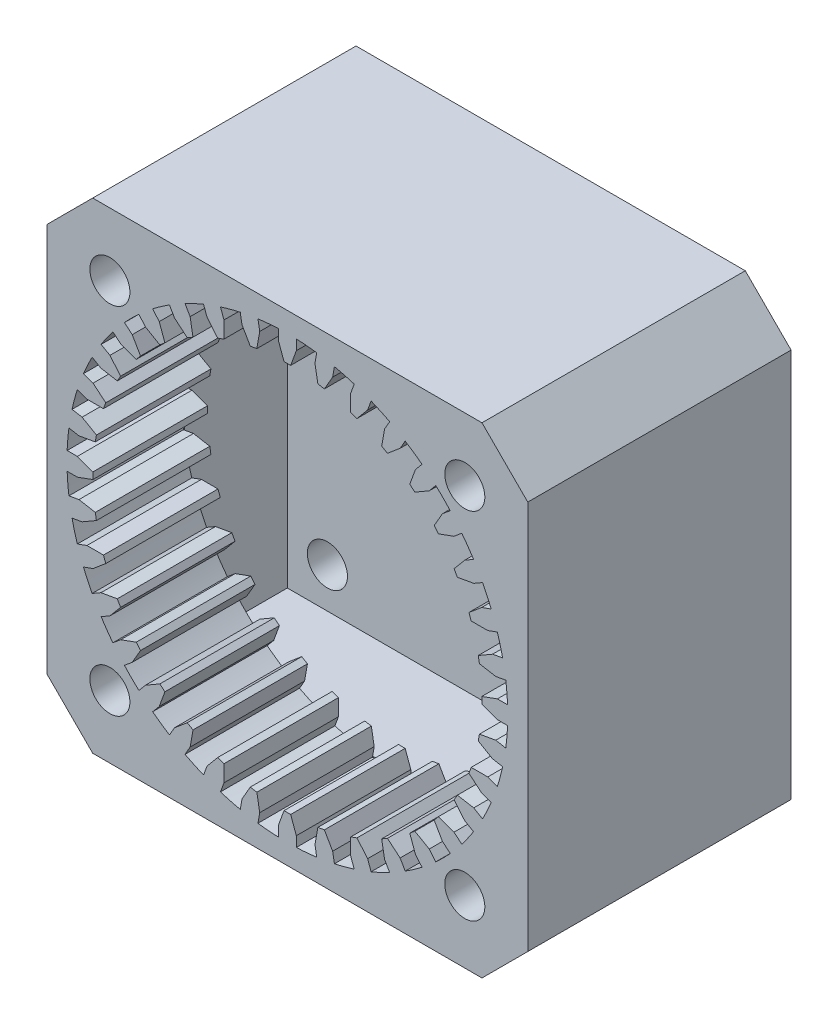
SolidWorks part; units mm, degrees
ref_plane "Piano frontale" through (0, 0, 0) normal (0, 0, 1) x (1, 0, 0)
ref_plane "Piano superiore" through (0, 0, 0) normal (0, 1, 0) x (1, 0, 0)
ref_plane "Piano destro" through (0, 0, 0) normal (1, 0, 0) x (0, 0, -1)
sketch "Schizzo1" plane through (0, 0, 0) normal (0, 0, 1) x (1, 0, 0)
  line L1 (21, -21) -> (-21, -21)
  line L2 (21, -21) -> (21, 21)
  line L3 (21, 21) -> (-21, 21)
  line L4 (-21, -21) -> (-21, 21)
  line L5 (21, -21) -> (-21, 21) construction
  line L6 (21, 21) -> (-21, -21) construction
  point P0 (0, 0)
  dimension "D1" = 42
  dimension "D2" = 42
extrude "Estrusione-Estrusione1" add sketch "Schizzo1" along normal blind 13
sketch "Schizzo2" plane through (0, 0, 13) normal (0, 0, 1) x (1, 0, 0)
  line L1 (19, -19) -> (-19, -19)
  line L2 (19, -19) -> (19, 19)
  line L3 (19, 19) -> (-19, 19)
  line L4 (-19, -19) -> (-19, 19)
  line L5 (19, -19) -> (-19, 19) construction
  line L6 (19, 19) -> (-19, -19) construction
  point P0 (0, 0)
  dimension "D1" = 38
  dimension "D2" = 38
extrude "Taglio-Estrusione1" cut sketch "Schizzo2" against normal blind 9
sketch "Schizzo3" plane through (0, 0, 4) normal (0, 0, 1) x (1, 0, 0)
  line L0 (0, 16.6126) -> (0, -15.5) construction
  line L7 (-15.8688, 0) -> (16.532, 0) construction
  circle A0 centre (-15.5, 15.5) radius 1.75
  circle A1 centre (15.5, 15.5) radius 1.75
  circle A2 centre (15.5, -15.5) radius 1.75
  circle A3 centre (-15.5, -15.5) radius 1.75
  point P0 (0, 0)
  dimension "D3" = 3.5
  dimension "D1" = 31
  dimension "D2" = 31
extrude "Taglio-Estrusione2" cut sketch "Schizzo3" against normal through all
sketch "Schizzo4" plane through (0, 0, 13) normal (0, 0, 1) x (1, 0, 0)
  line L0 (-24.8225, 0) -> (21.9573, 0) construction
  line L1 (19.234, 0.785) -> (18.344, 0.785)
  line L2 (18.344, 0.785) -> (16.984, 0.29)
  line L3 (16.984, 0.29) -> (16.984, -0.29)
  line L4 (16.984, -0.29) -> (18.344, -0.785)
  line L5 (18.344, -0.785) -> (19.234, -0.785)
  line L6 (18.2016, -2.4123) -> (16.7763, -2.6636)
  line L7 (19.0781, -2.5669) -> (18.2016, -2.4123)
  line L8 (16.7763, -2.6636) -> (16.6756, -3.2348)
  line L9 (16.6756, -3.2348) -> (17.929, -3.9585)
  line L10 (17.929, -3.9585) -> (18.8055, -4.113)
  line L11 (17.5062, -5.5364) -> (16.0589, -5.5364)
  line L12 (18.3425, -5.8408) -> (17.5062, -5.5364)
  line L13 (16.0589, -5.5364) -> (15.8605, -6.0814)
  line L14 (15.8605, -6.0814) -> (16.9692, -7.0117)
  line L15 (16.9692, -7.0117) -> (17.8056, -7.3161)
  line L16 (16.2789, -8.4922) -> (14.8536, -8.2408)
  line L17 (17.0496, -8.9372) -> (16.2789, -8.4922)
  line L18 (14.8536, -8.2408) -> (14.5636, -8.7431)
  line L19 (14.5636, -8.7431) -> (15.4939, -9.8518)
  line L20 (15.4939, -9.8518) -> (16.2646, -10.2968)
  line L21 (14.5569, -11.1899) -> (13.1969, -10.6949)
  line L22 (15.2387, -11.762) -> (14.5569, -11.1899)
  line L23 (13.1969, -10.6949) -> (12.8241, -11.1392)
  line L24 (12.8241, -11.1392) -> (13.5477, -12.3926)
  line L25 (13.5477, -12.3926) -> (14.2295, -12.9647)
  line L26 (12.3926, -13.5477) -> (11.1392, -12.8241)
  line L27 (12.9647, -14.2295) -> (12.3926, -13.5477)
  line L28 (11.1392, -12.8241) -> (10.6949, -13.1969)
  line L29 (10.6949, -13.1969) -> (11.1899, -14.5569)
  line L30 (11.1899, -14.5569) -> (11.762, -15.2387)
  line L31 (9.8518, -15.4939) -> (8.7431, -14.5636)
  line L32 (10.2968, -16.2646) -> (9.8518, -15.4939)
  line L33 (8.7431, -14.5636) -> (8.2408, -14.8536)
  line L34 (8.2408, -14.8536) -> (8.4922, -16.2789)
  line L35 (8.4922, -16.2789) -> (8.9372, -17.0496)
  line L36 (7.0117, -16.9692) -> (6.0814, -15.8605)
  line L37 (7.3161, -17.8056) -> (7.0117, -16.9692)
  line L38 (6.0814, -15.8605) -> (5.5364, -16.0589)
  line L39 (5.5364, -16.0589) -> (5.5364, -17.5062)
  line L40 (5.5364, -17.5062) -> (5.8408, -18.3425)
  line L41 (3.9585, -17.929) -> (3.2348, -16.6756)
  line L42 (4.113, -18.8055) -> (3.9585, -17.929)
  line L43 (3.2348, -16.6756) -> (2.6636, -16.7763)
  line L44 (2.6636, -16.7763) -> (2.4123, -18.2016)
  line L45 (2.4123, -18.2016) -> (2.5669, -19.0781)
  line L46 (0.785, -18.344) -> (0.29, -16.984)
  line L47 (0.785, -19.234) -> (0.785, -18.344)
  line L48 (0.29, -16.984) -> (-0.29, -16.984)
  line L49 (-0.29, -16.984) -> (-0.785, -18.344)
  line L50 (-0.785, -18.344) -> (-0.785, -19.234)
  line L51 (-2.4123, -18.2016) -> (-2.6636, -16.7763)
  line L52 (-2.5669, -19.0781) -> (-2.4123, -18.2016)
  line L53 (-2.6636, -16.7763) -> (-3.2348, -16.6756)
  line L54 (-3.2348, -16.6756) -> (-3.9585, -17.929)
  line L55 (-3.9585, -17.929) -> (-4.113, -18.8055)
  line L56 (-5.5364, -17.5062) -> (-5.5364, -16.0589)
  line L57 (-5.8408, -18.3425) -> (-5.5364, -17.5062)
  line L58 (-5.5364, -16.0589) -> (-6.0814, -15.8605)
  line L59 (-6.0814, -15.8605) -> (-7.0117, -16.9692)
  line L60 (-7.0117, -16.9692) -> (-7.3161, -17.8056)
  line L61 (-8.4922, -16.2789) -> (-8.2408, -14.8536)
  line L62 (-8.9372, -17.0496) -> (-8.4922, -16.2789)
  line L63 (-8.2408, -14.8536) -> (-8.7431, -14.5636)
  line L64 (-8.7431, -14.5636) -> (-9.8518, -15.4939)
  line L65 (-9.8518, -15.4939) -> (-10.2968, -16.2646)
  line L66 (-11.1899, -14.5569) -> (-10.6949, -13.1969)
  line L67 (-11.762, -15.2387) -> (-11.1899, -14.5569)
  line L68 (-10.6949, -13.1969) -> (-11.1392, -12.8241)
  line L69 (-11.1392, -12.8241) -> (-12.3926, -13.5477)
  line L70 (-12.3926, -13.5477) -> (-12.9647, -14.2295)
  line L71 (-13.5477, -12.3926) -> (-12.8241, -11.1392)
  line L72 (-14.2295, -12.9647) -> (-13.5477, -12.3926)
  line L73 (-12.8241, -11.1392) -> (-13.1969, -10.6949)
  line L74 (-13.1969, -10.6949) -> (-14.5569, -11.1899)
  line L75 (-14.5569, -11.1899) -> (-15.2387, -11.762)
  line L76 (-15.4939, -9.8518) -> (-14.5636, -8.7431)
  line L77 (-16.2646, -10.2968) -> (-15.4939, -9.8518)
  line L78 (-14.5636, -8.7431) -> (-14.8536, -8.2408)
  line L79 (-14.8536, -8.2408) -> (-16.2789, -8.4922)
  line L80 (-16.2789, -8.4922) -> (-17.0496, -8.9372)
  line L81 (-16.9692, -7.0117) -> (-15.8605, -6.0814)
  line L82 (-17.8056, -7.3161) -> (-16.9692, -7.0117)
  line L83 (-15.8605, -6.0814) -> (-16.0589, -5.5364)
  line L84 (-16.0589, -5.5364) -> (-17.5062, -5.5364)
  line L85 (-17.5062, -5.5364) -> (-18.3425, -5.8408)
  line L86 (-17.929, -3.9585) -> (-16.6756, -3.2348)
  line L87 (-18.8055, -4.113) -> (-17.929, -3.9585)
  line L88 (-16.6756, -3.2348) -> (-16.7763, -2.6636)
  line L89 (-16.7763, -2.6636) -> (-18.2016, -2.4123)
  line L90 (-18.2016, -2.4123) -> (-19.0781, -2.5669)
  line L91 (-18.344, -0.785) -> (-16.984, -0.29)
  line L92 (-19.234, -0.785) -> (-18.344, -0.785)
  line L93 (-16.984, -0.29) -> (-16.984, 0.29)
  line L94 (-16.984, 0.29) -> (-18.344, 0.785)
  line L95 (-18.344, 0.785) -> (-19.234, 0.785)
  line L96 (-18.2016, 2.4123) -> (-16.7763, 2.6636)
  line L97 (-19.0781, 2.5669) -> (-18.2016, 2.4123)
  line L98 (-16.7763, 2.6636) -> (-16.6756, 3.2348)
  line L99 (-16.6756, 3.2348) -> (-17.929, 3.9585)
  line L100 (-17.929, 3.9585) -> (-18.8055, 4.113)
  line L101 (-17.5062, 5.5364) -> (-16.0589, 5.5364)
  line L102 (-18.3425, 5.8408) -> (-17.5062, 5.5364)
  line L103 (-16.0589, 5.5364) -> (-15.8605, 6.0814)
  line L104 (-15.8605, 6.0814) -> (-16.9692, 7.0117)
  line L105 (-16.9692, 7.0117) -> (-17.8056, 7.3161)
  line L106 (-16.2789, 8.4922) -> (-14.8536, 8.2408)
  line L107 (-17.0496, 8.9372) -> (-16.2789, 8.4922)
  line L108 (-14.8536, 8.2408) -> (-14.5636, 8.7431)
  line L109 (-14.5636, 8.7431) -> (-15.4939, 9.8518)
  line L110 (-15.4939, 9.8518) -> (-16.2646, 10.2968)
  line L111 (-14.5569, 11.1899) -> (-13.1969, 10.6949)
  line L112 (-15.2387, 11.762) -> (-14.5569, 11.1899)
  line L113 (-13.1969, 10.6949) -> (-12.8241, 11.1392)
  line L114 (-12.8241, 11.1392) -> (-13.5477, 12.3926)
  line L115 (-13.5477, 12.3926) -> (-14.2295, 12.9647)
  line L116 (-12.3926, 13.5477) -> (-11.1392, 12.8241)
  line L117 (-12.9647, 14.2295) -> (-12.3926, 13.5477)
  line L118 (-11.1392, 12.8241) -> (-10.6949, 13.1969)
  line L119 (-10.6949, 13.1969) -> (-11.1899, 14.5569)
  line L120 (-11.1899, 14.5569) -> (-11.762, 15.2387)
  line L121 (-9.8518, 15.4939) -> (-8.7431, 14.5636)
  line L122 (-10.2968, 16.2646) -> (-9.8518, 15.4939)
  line L123 (-8.7431, 14.5636) -> (-8.2408, 14.8536)
  line L124 (-8.2408, 14.8536) -> (-8.4922, 16.2789)
  line L125 (-8.4922, 16.2789) -> (-8.9372, 17.0496)
  line L126 (-7.0117, 16.9692) -> (-6.0814, 15.8605)
  line L127 (-7.3161, 17.8056) -> (-7.0117, 16.9692)
  line L128 (-6.0814, 15.8605) -> (-5.5364, 16.0589)
  line L129 (-5.5364, 16.0589) -> (-5.5364, 17.5062)
  line L130 (-5.5364, 17.5062) -> (-5.8408, 18.3425)
  line L131 (-3.9585, 17.929) -> (-3.2348, 16.6756)
  line L132 (-4.113, 18.8055) -> (-3.9585, 17.929)
  line L133 (-3.2348, 16.6756) -> (-2.6636, 16.7763)
  line L134 (-2.6636, 16.7763) -> (-2.4123, 18.2016)
  line L135 (-2.4123, 18.2016) -> (-2.5669, 19.0781)
  line L136 (-0.785, 18.344) -> (-0.29, 16.984)
  line L137 (-0.785, 19.234) -> (-0.785, 18.344)
  line L138 (-0.29, 16.984) -> (0.29, 16.984)
  line L139 (0.29, 16.984) -> (0.785, 18.344)
  line L140 (0.785, 18.344) -> (0.785, 19.234)
  line L141 (2.4123, 18.2016) -> (2.6636, 16.7763)
  line L142 (2.5669, 19.0781) -> (2.4123, 18.2016)
  line L143 (2.6636, 16.7763) -> (3.2348, 16.6756)
  line L144 (3.2348, 16.6756) -> (3.9585, 17.929)
  line L145 (3.9585, 17.929) -> (4.113, 18.8055)
  line L146 (5.5364, 17.5062) -> (5.5364, 16.0589)
  line L147 (5.8408, 18.3425) -> (5.5364, 17.5062)
  line L148 (5.5364, 16.0589) -> (6.0814, 15.8605)
  line L149 (6.0814, 15.8605) -> (7.0117, 16.9692)
  line L150 (7.0117, 16.9692) -> (7.3161, 17.8056)
  line L151 (8.4922, 16.2789) -> (8.2408, 14.8536)
  line L152 (8.9372, 17.0496) -> (8.4922, 16.2789)
  line L153 (8.2408, 14.8536) -> (8.7431, 14.5636)
  line L154 (8.7431, 14.5636) -> (9.8518, 15.4939)
  line L155 (9.8518, 15.4939) -> (10.2968, 16.2646)
  line L156 (11.1899, 14.5569) -> (10.6949, 13.1969)
  line L157 (11.762, 15.2387) -> (11.1899, 14.5569)
  line L158 (10.6949, 13.1969) -> (11.1392, 12.8241)
  line L159 (11.1392, 12.8241) -> (12.3926, 13.5477)
  line L160 (12.3926, 13.5477) -> (12.9647, 14.2295)
  line L161 (13.5477, 12.3926) -> (12.8241, 11.1392)
  line L162 (14.2295, 12.9647) -> (13.5477, 12.3926)
  line L163 (12.8241, 11.1392) -> (13.1969, 10.6949)
  line L164 (13.1969, 10.6949) -> (14.5569, 11.1899)
  line L165 (14.5569, 11.1899) -> (15.2387, 11.762)
  line L166 (15.4939, 9.8518) -> (14.5636, 8.7431)
  line L167 (16.2646, 10.2968) -> (15.4939, 9.8518)
  line L168 (14.5636, 8.7431) -> (14.8536, 8.2408)
  line L169 (14.8536, 8.2408) -> (16.2789, 8.4922)
  line L170 (16.2789, 8.4922) -> (17.0496, 8.9372)
  line L171 (16.9692, 7.0117) -> (15.8605, 6.0814)
  line L172 (17.8056, 7.3161) -> (16.9692, 7.0117)
  line L173 (15.8605, 6.0814) -> (16.0589, 5.5364)
  line L174 (16.0589, 5.5364) -> (17.5062, 5.5364)
  line L175 (17.5062, 5.5364) -> (18.3425, 5.8408)
  line L176 (17.929, 3.9585) -> (16.6756, 3.2348)
  line L177 (18.8055, 4.113) -> (17.929, 3.9585)
  line L178 (16.6756, 3.2348) -> (16.7763, 2.6636)
  line L179 (16.7763, 2.6636) -> (18.2016, 2.4123)
  line L180 (18.2016, 2.4123) -> (19.0781, 2.5669)
  line L185 (-21, 21) -> (-21, -21)
  line L186 (-21, -21) -> (21, -21)
  line L187 (21, -21) -> (21, 21)
  line L188 (21, 21) -> (-21, 21)
  line L189 (-21, 21) -> (-21, -21)
  line L190 (-21, -21) -> (21, -21)
  line L191 (21, -21) -> (21, 21)
  line L192 (21, 21) -> (-21, 21)
  arc A0 (17.0496, -8.9372) -> (17.8056, -7.3161) centre (0, 0) ccw
  arc A1 (15.2387, -11.762) -> (16.2646, -10.2968) centre (0, 0) ccw
  arc A2 (12.9647, -14.2295) -> (14.2295, -12.9647) centre (0, 0) ccw
  arc A3 (10.2968, -16.2646) -> (11.762, -15.2387) centre (0, 0) ccw
  arc A4 (7.3161, -17.8056) -> (8.9372, -17.0496) centre (0, 0) ccw
  arc A5 (4.113, -18.8055) -> (5.8408, -18.3425) centre (0, 0) ccw
  arc A6 (0.785, -19.234) -> (2.5669, -19.0781) centre (0, 0) ccw
  arc A7 (-2.5669, -19.0781) -> (-0.785, -19.234) centre (0, 0) ccw
  arc A8 (-5.8408, -18.3425) -> (-4.113, -18.8055) centre (0, 0) ccw
  arc A9 (-8.9372, -17.0496) -> (-7.3161, -17.8056) centre (0, 0) ccw
  arc A10 (-11.762, -15.2387) -> (-10.2968, -16.2646) centre (0, 0) ccw
  arc A11 (-14.2295, -12.9647) -> (-12.9647, -14.2295) centre (0, 0) ccw
  arc A12 (-16.2646, -10.2968) -> (-15.2387, -11.762) centre (0, 0) ccw
  arc A13 (-17.8056, -7.3161) -> (-17.0496, -8.9372) centre (0, 0) ccw
  arc A14 (-18.8055, -4.113) -> (-18.3425, -5.8408) centre (0, 0) ccw
  arc A15 (-19.234, -0.785) -> (-19.0781, -2.5669) centre (0, 0) ccw
  arc A16 (-19.0781, 2.5669) -> (-19.234, 0.785) centre (0, 0) ccw
  arc A17 (-18.3425, 5.8408) -> (-18.8055, 4.113) centre (0, 0) ccw
  arc A18 (-17.0496, 8.9372) -> (-17.8056, 7.3161) centre (0, 0) ccw
  arc A19 (-15.2387, 11.762) -> (-16.2646, 10.2968) centre (0, 0) ccw
  arc A20 (-12.9647, 14.2295) -> (-14.2295, 12.9647) centre (0, 0) ccw
  arc A21 (-10.2968, 16.2646) -> (-11.762, 15.2387) centre (0, 0) ccw
  arc A22 (-7.3161, 17.8056) -> (-8.9372, 17.0496) centre (0, 0) ccw
  arc A23 (-4.113, 18.8055) -> (-5.8408, 18.3425) centre (0, 0) ccw
  arc A24 (-0.785, 19.234) -> (-2.5669, 19.0781) centre (0, 0) ccw
  arc A25 (2.5669, 19.0781) -> (0.785, 19.234) centre (0, 0) ccw
  arc A26 (5.8408, 18.3425) -> (4.113, 18.8055) centre (0, 0) ccw
  arc A27 (8.9372, 17.0496) -> (7.3161, 17.8056) centre (0, 0) ccw
  arc A28 (11.762, 15.2387) -> (10.2968, 16.2646) centre (0, 0) ccw
  arc A29 (14.2295, 12.9647) -> (12.9647, 14.2295) centre (0, 0) ccw
  arc A30 (16.2646, 10.2968) -> (15.2387, 11.762) centre (0, 0) ccw
  arc A31 (17.8056, 7.3161) -> (17.0496, 8.9372) centre (0, 0) ccw
  arc A32 (18.8055, 4.113) -> (18.3425, 5.8408) centre (0, 0) ccw
  arc A33 (19.234, 0.785) -> (19.0781, 2.5669) centre (0, 0) ccw
  arc A34 (18.3425, -5.8408) -> (18.8055, -4.113) centre (0, 0) ccw
  arc A35 (19.0781, -2.5669) -> (19.234, -0.785) centre (0, 0) ccw
  point P223 (0, 0)
  dimension "D1" = 38.5
  dimension "D2" = 20
  dimension "D3" = 1.36
  dimension "D4" = 2.25
  dimension "D5" = 1.57
  dimension "D7" = 0
  dimension "D6" = 36
extrude "Estrusione-Estrusione2" add sketch "Schizzo4" along normal blind 10
sketch "Schizzo5" plane through (0, 0, 0) normal (0, 0, -1) x (-1, 0, 0)
  circle A0 centre (0, 0) radius 2.75
  circle A1 centre (15.5, -15.5) radius 1.75 construction
  circle A2 centre (-15.5, -15.5) radius 1.75 construction
  circle A3 centre (-15.5, 15.5) radius 1.75 construction
  circle A4 centre (15.5, 15.5) radius 1.75 construction
  circle A5 centre (15.5, -15.5) radius 1.75
  circle A6 centre (-15.5, -15.5) radius 1.75
  circle A7 centre (-15.5, 15.5) radius 1.75
  circle A8 centre (15.5, 15.5) radius 1.75
  dimension "D1" = 5.5
extrude "Taglio-Estrusione3" cut sketch "Schizzo5" against normal through all
sketch "Schizzo6" plane through (0, 0, 23) normal (0, 0, 1) x (1, 0, 0)
  circle A0 centre (0, 0) radius 36 construction
  dimension "D1" = 72
sketch "Schizzo7" plane through (0, 0, 0) normal (0, 0, -1) x (-1, 0, 0)
  circle A0 centre (0, 0) radius 11
  dimension "D1" = 22
extrude "Taglio-Estrusione4" cut sketch "Schizzo7" against normal blind 3
chamfer "Smusso1" distance 4 angle 45 4 edges at (-21, -21, 11.5) (21, -21, 11.5) (21, 21, 11.5) (-21, 21, 11.5)
